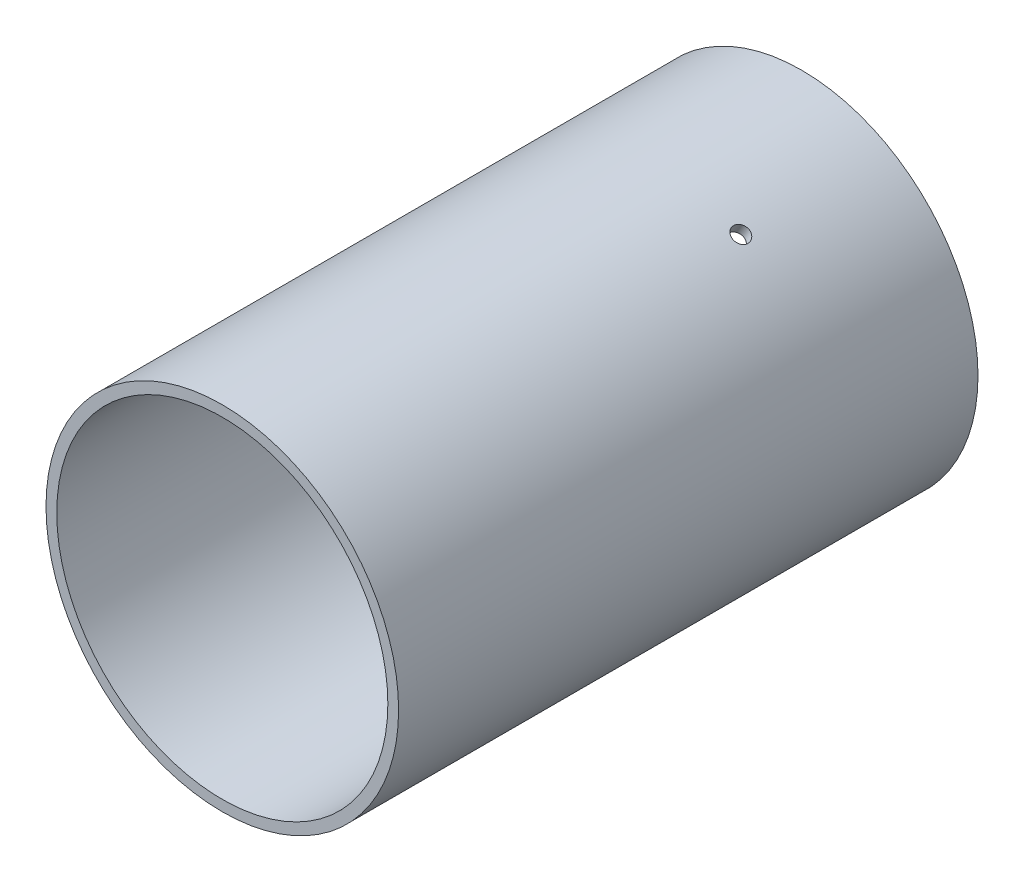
SolidWorks part; units mm, degrees
ref_plane "Front Plane" through (0, 0, 0) normal (0, 0, 1) x (1, 0, 0)
ref_plane "Top Plane" through (0, 0, 0) normal (0, 1, 0) x (1, 0, 0)
ref_plane "Right Plane" through (0, 0, 0) normal (1, 0, 0) x (0, 0, -1)
sketch "Sketch1" plane through (0, 0, 0) normal (0, 0, 1) x (1, 0, 0)
  circle A0 centre (0, 0) radius 27.051
  circle A1 centre (0, 0) radius 25.4
extrude "Extrude1" add sketch "Sketch1" along normal blind 88.9
sketch "Sketch2" plane through (0, 0, 0) normal (1, 0, 0) x (0, 0, -1)
  line L0 (0, -27.051) -> (0, 27.051) construction
  circle A0 centre (-22.86, 0) radius 1.27
  dimension "D1" = 2.54
  dimension "D2" = 22.86
extrude "Cut-Extrude1" cut sketch "Sketch2" against normal through all
sketch "Sketch6" plane through (0, 0, 0) normal (1, 0, 0) x (0, 0, -1)
  line L0 (5.3163, 0) -> (-105.169, 0) construction
ref_plane "Plane3" through (0, 0, 0) normal (-0.5, 0.866, 0) x (-0.866, -0.5, 0)
sketch "Sketch7" plane through (0, 0, 0) normal (-0.5, 0.866, 0) x (-0.866, -0.5, 0)
  line L0 (0, -5.3163) -> (0, 105.169) construction
  line L1 (-27.051, 0) -> (27.051, 0) construction
  circle A0 centre (0, 22.86) radius 1.27
  dimension "D2" = 2.54
  dimension "D1" = 22.86
extrude "Cut-Extrude2" cut sketch "Sketch7" against normal through all
ref_plane "Plane4" through (0, 0, 0) normal (-0.5, -0.866, 0) x (0.866, -0.5, 0)
sketch "Sketch8" plane through (0, 0, 0) normal (-0.5, -0.866, 0) x (0.866, -0.5, 0)
  line L0 (0, -5.3163) -> (0, 105.169) construction
  circle A0 centre (0, 22.86) radius 1.27
  dimension "D2" = 2.54
  dimension "D1" = 22.86
extrude "Cut-Extrude3" cut sketch "Sketch8" against normal through all
